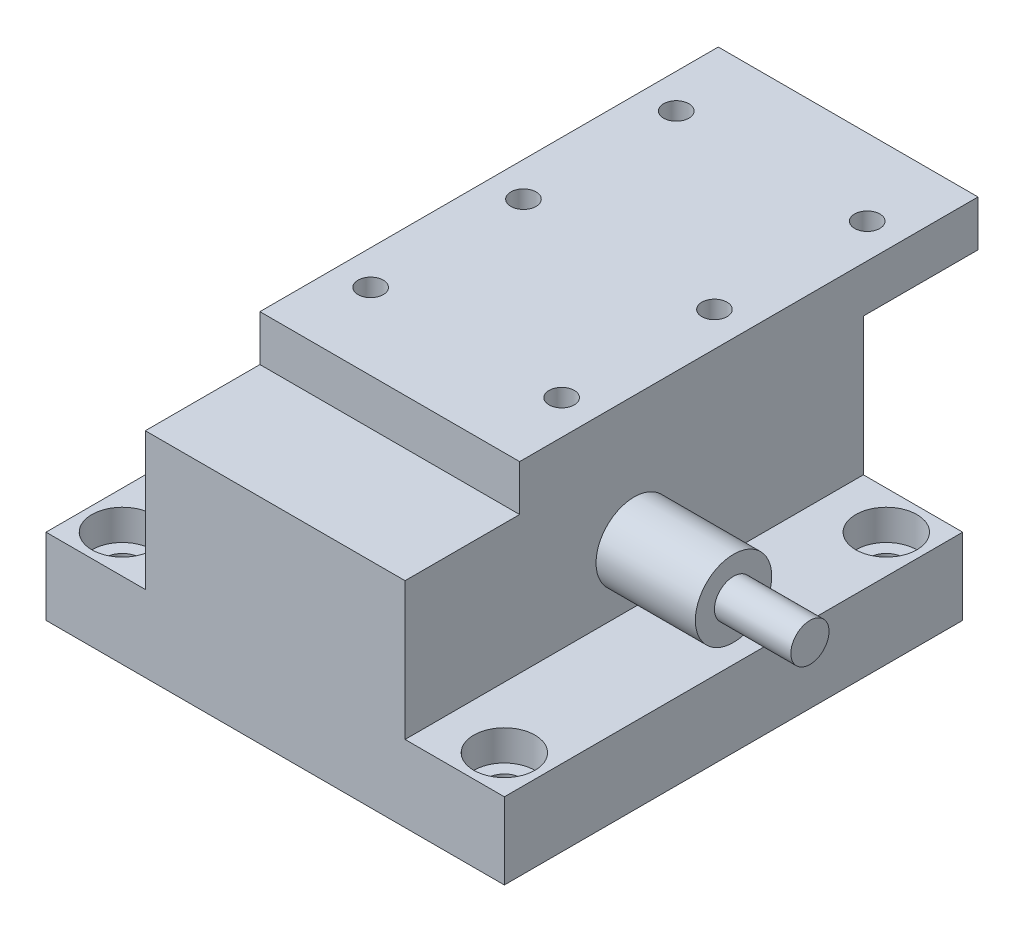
SolidWorks part; units mm, degrees
ref_plane "Front Plane" through (0, 0, 0) normal (0, 0, 1) x (1, 0, 0)
ref_plane "Top Plane" through (0, 0, 0) normal (0, 1, 0) x (1, 0, 0)
ref_plane "Right Plane" through (0, 0, 0) normal (1, 0, 0) x (0, 0, -1)
sketch "Sketch1" plane through (0, 0, 0) normal (1, 0, 0) x (0, 0, -1)
  line L1 (0, 0) -> (60, 0)
  line L2 (0, 0) -> (0, 10)
  line L3 (0, 10) -> (60, 10)
  line L4 (60, 0) -> (60, 10)
  dimension "D1" = 10
  dimension "D2" = 60
extrude "Boss-Extrude1" add sketch "Sketch1" along normal mid plane 60
sketch "Sketch2" plane through (0, 10, 0) normal (0, 1, 0) x (1, 0, 0)
  line L0 (30, 60) -> (-30, 60) construction
  line L1 (-17, 0) -> (17, 0)
  line L2 (-17, 0) -> (-17, 60)
  line L3 (-17, 60) -> (17, 60)
  line L4 (17, 0) -> (17, 60)
  line L5 (-30, 60) -> (-30, 0) construction
  dimension "D1" = 34
  dimension "D2" = 60
  dimension "D3" = 0
  dimension "D4" = 13
extrude "Boss-Extrude2" add sketch "Sketch2" along normal blind 18
sketch "Sketch3" plane through (17, 0, 0) normal (1, 0, 0) x (0, 0, -1)
  line L0 (60, 28) -> (60, 10) construction
  line L1 (0, 0) -> (60, 0) construction
  circle A0 centre (30, 17.5) radius 5
  dimension "D3" = 10
  dimension "D1" = 30
  dimension "D2" = 17.5
extrude "Boss-Extrude3" add sketch "Sketch3" along normal blind 13
hole_wizard "CBORE for M4 SHCS1" positions "Sketch9" profile "Sketch8" counterbore size "M4" standard "ANSI Metric"
sketch "Sketch9" plane through (0, 10, 0) normal (0, 1, 0) x (1, 0, 0)
  line L0 (-30, 60) -> (-30, 0) construction
  line L1 (30, 60) -> (30, 0) construction
  line L2 (30, 60) -> (17, 60) construction
  line L3 (-17, 60) -> (-30, 60) construction
  line L4 (30, 0) -> (17, 0) construction
  line L5 (-17, 0) -> (-30, 0) construction
  point P0 (-25, 55)
  point P2 (-25, 5)
  point P4 (25, 5)
  point P6 (25, 55)
  dimension "D1" = 5
  dimension "D2" = 5
  dimension "D3" = 5
  dimension "D4" = 5
  dimension "D5" = 5
  dimension "D6" = 5
  dimension "D7" = 5
  dimension "D8" = 5
sketch "Sketch8" plane through (-25, 10, -55) normal (1, 0, 0) x (0, 0, 1)
  line L0 (0, 0) -> (0, 10)
  line L1 (0, 10) -> (2.25, 10)
  line L3 (2.25, 10) -> (2.25, 4)
  line L4 (2.25, 4) -> (4, 4)
  line L5 (4, 4) -> (4, 0)
  line L7 (4, 0) -> (0, 0)
  line L11 (0, -6.35) -> (0, 107.95) construction
  dimension "Thru Hole Dia." = 4.5
  dimension "Thru Hole Depth" = 10
  dimension "C'Bore Dia." = 8
  dimension "C'Bore Depth" = 4
sketch "Sketch10" plane through (0, 28, 0) normal (0, 1, 0) x (1, 0, 0)
  line L0 (-17, 60) -> (-17, 0) construction
  line L1 (-17, 15) -> (17, 15)
  line L2 (-17, 15) -> (-17, 75)
  line L3 (-17, 75) -> (17, 75)
  line L4 (17, 15) -> (17, 75)
  line L6 (17, 60) -> (-17, 60) construction
  dimension "D1" = 34
  dimension "D2" = 60
  dimension "D3" = 45
extrude "Boss-Extrude4" add sketch "Sketch10" along normal blind 6
hole_wizard "M4x0.7 Tapped Hole1" positions "Sketch12" profile "Sketch11" tap size "M4x0.7" standard "ANSI Metric"
sketch "Sketch12" plane through (0, 34, 0) normal (0, 1, 0) x (1, 0, 0)
  line L0 (-12.5, 65) -> (-12.5, 45) construction
  line L1 (-12.5, 45) -> (-12.5, 25) construction
  line L2 (-12.5, 25) -> (12.5, 25) construction
  line L3 (12.5, 25) -> (12.5, 45) construction
  line L4 (12.5, 45) -> (12.5, 65) construction
  line L5 (12.5, 65) -> (-12.5, 65) construction
  line L7 (-12.5, 45) -> (12.5, 45) construction
  line L9 (-17, 60) -> (-17, 0) construction
  line L10 (17, 75) -> (-17, 75) construction
  point P0 (-12.5, 65)
  point P2 (12.5, 65)
  point P4 (12.5, 45)
  point P6 (-12.5, 45)
  point P8 (-12.5, 25)
  point P10 (12.5, 25)
  dimension "D1" = 25
  dimension "D2" = 4.5
  dimension "D3" = 10
  dimension "D4" = 20
  dimension "D5" = 20
sketch "Sketch11" plane through (-12.5, 34, -65) normal (1, 0, 0) x (0, 0, 1)
  line L0 (0, 0) -> (0, 7.9914)
  line L1 (0, 7.9914) -> (1.65, 7)
  line L2 (1.65, 7) -> (1.65, 0)
  line L5 (1.65, 0) -> (0, 0)
  line L10 (0, 7.9914) -> (-1.65, 7) construction
  line L11 (0, -6.35) -> (0, 107.95) construction
  dimension "Tap Drill Dia." = 3.3
  dimension "Tap Drill Depth" = 7
  dimension "Drill Angle" = 118
sketch "Sketch13" plane through (30, 0, 0) normal (1, 0, 0) x (0, 0, -1)
  circle A0 centre (30, 17.5) radius 2.5
  dimension "D1" = 5
extrude "Boss-Extrude5" add sketch "Sketch13" along normal blind 10
